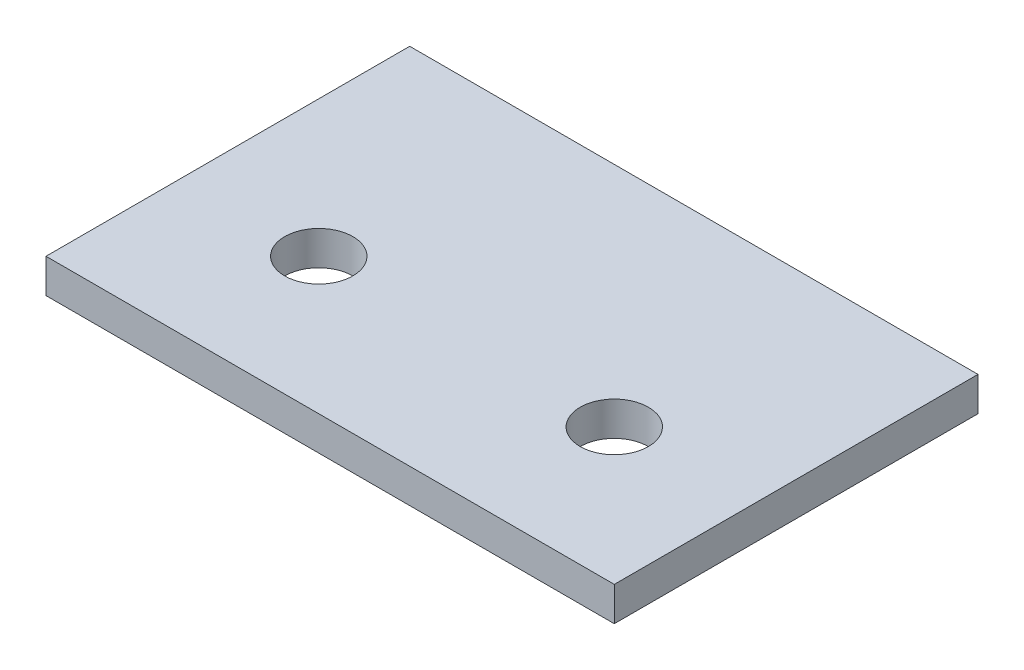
SolidWorks part; units mm, degrees
ref_plane "Front" through (0, 0, 0) normal (0, 0, 1) x (1, 0, 0)
ref_plane "Top" through (0, 0, 0) normal (0, 1, 0) x (1, 0, 0)
ref_plane "Right" through (0, 0, 0) normal (1, 0, 0) x (0, 0, -1)
sketch "草图1" plane through (0, 0, 0) normal (0, 1, 0) x (1, 0, 0)
  line L1 (0, 0) -> (25, 0)
  line L2 (0, 0) -> (0, 16)
  line L3 (0, 16) -> (25, 16)
  line L4 (25, 0) -> (25, 16)
  circle A0 centre (6, 6) radius 1.5
  circle A1 centre (19, 6) radius 1.5
  dimension "D3" = 3
  dimension "D4" = 3
  dimension "D1" = 25
  dimension "D2" = 16
  dimension "D5" = 10
  dimension "D6" = 10
  dimension "D7" = 13
  dimension "D8" = 6
extrude "凸台-拉伸1" add sketch "草图1" along normal blind 1.5
